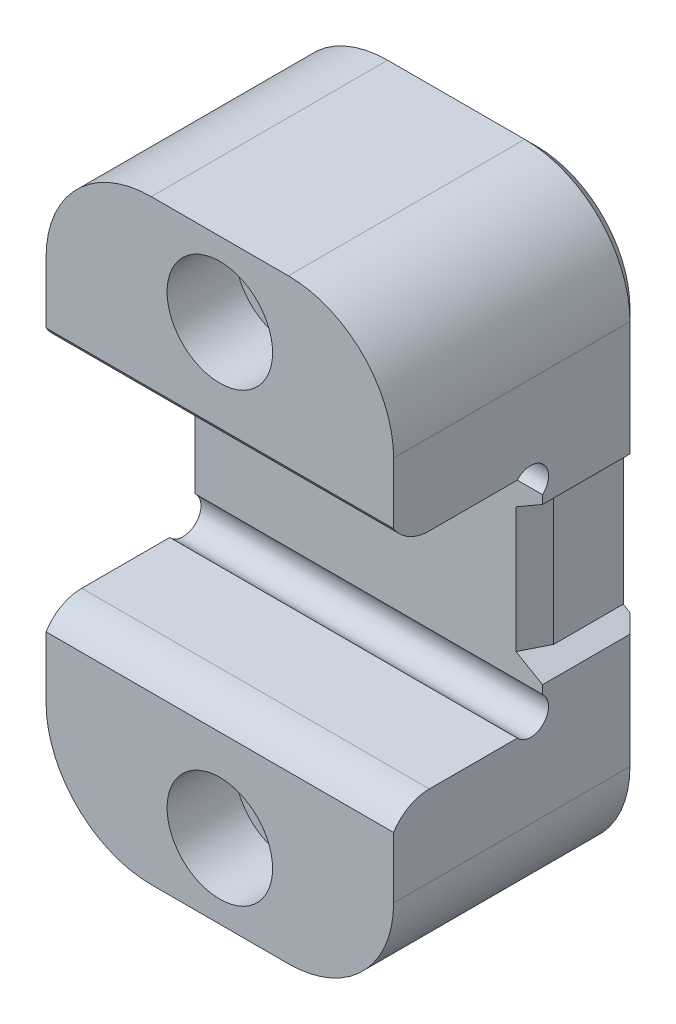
SolidWorks part; units mm, degrees
ref_plane "Front Plane" through (0, 0, 0) normal (0, 0, 1) x (1, 0, 0)
ref_plane "Top Plane" through (0, 0, 0) normal (0, 1, 0) x (1, 0, 0)
ref_plane "Right Plane" through (0, 0, 0) normal (1, 0, 0) x (0, 0, -1)
sketch "Sketch1" plane through (0, 0, 0) normal (1, 0, 0) x (0, 0, -1)
  line L0 (0, 0) -> (50000, 0) construction
  line L1 (0, 14.2875) -> (19.05, 14.2875)
  line L2 (0, 38.1) -> (31.75, 38.1)
  line L3 (0, 38.1) -> (0, 14.2875)
  line L4 (0, -38.1) -> (31.75, -38.1)
  line L5 (31.75, 38.1) -> (31.75, -38.1)
  line L6 (19.05, 14.2875) -> (19.05, -14.2875)
  line L7 (19.05, -14.2875) -> (0, -14.2875)
  line L9 (0, 24.4475) -> (0, -24.4475) construction
  line L10 (0, -14.2875) -> (0, -38.1)
  dimension "D1" = 31.75
  dimension "D2" = 76.2
  dimension "D3" = 19.05
  dimension "D4" = 28.575
extrude "Extrude1" add sketch "Sketch1" along normal mid plane 44.45
fillet "Fillet1" radius 13.462 4 edges at (-22.225, -38.1, -15.875) (-22.225, 38.1, -15.875) (22.225, -38.1, -15.875) (22.225, 38.1, -15.875)
sketch "Sketch2" plane through (-9.525, 0, -31.75) normal (0, 0, 1) x (1, 0, 0)
  line L0 (0, 0) -> (50000, 0) construction
  line L1 (31.75, -24.638) -> (31.75, 24.638) construction
  line L2 (29.3687, 8.6085) -> (32.5437, 10.4415)
  line L3 (29.3687, 8.6085) -> (29.3687, -8.6085)
  line L4 (29.3687, -8.6085) -> (32.5437, -10.4415)
  line L5 (32.5437, 10.4415) -> (32.5437, -10.4415)
  point P4 (30.9562, 9.525)
  point P10 (30.9562, -9.525)
  dimension "D1" = 19.05
  dimension "D2" = 2.3813
  dimension "D3" = 30
  dimension "D4" = 3.175
extrude "Cut-Extrude1" cut sketch "Sketch2" along normal through all
sketch "Sketch5" plane through (22.225, 0, 0) normal (1, 0, 0) x (0, 0, -1)
  line L0 (0, 0) -> (50000, 0) construction
  line L2 (0, 24.638) -> (0, 14.2875) construction
  line L3 (0, -14.2875) -> (0, -24.638) construction
  line L4 (-1.778, -13.6525) -> (4.572, -13.6525)
  line L5 (-1.778, -13.6525) -> (-1.778, -16.8275)
  line L6 (-1.778, -16.8275) -> (0, -16.8275)
  line L7 (4.572, -13.6525) -> (4.572, -14.2875)
  line L8 (19.05, -14.2875) -> (0, -14.2875) construction
  line L9 (4.572, 13.6525) -> (4.572, 14.2875)
  line L10 (-1.778, 16.8275) -> (0, 16.8275)
  line L11 (-1.778, 13.6525) -> (-1.778, 16.8275)
  line L12 (-1.778, 13.6525) -> (4.572, 13.6525)
  arc A0 (1.7842, -14.5973) -> (4.572, -14.2875) centre (4.572, -26.9875) cw construction
  arc A1 (0, -16.8275) -> (1.7842, -14.5973) centre (2.286, -16.8275) cw construction
  arc A2 (0, 16.8275) -> (1.7842, 14.5973) centre (2.286, 16.8275) ccw construction
  arc A3 (1.7842, 14.5973) -> (4.572, 14.2875) centre (4.572, 26.9875) ccw construction
  arc A4 (0, -16.8275) -> (4.572, -14.2875) centre (4.572, -19.6723) cw
  arc A5 (0, 16.8275) -> (4.572, 14.2875) centre (4.572, 19.6723) ccw
  dimension "D1" = 2.286
  dimension "D2" = 12.7
  dimension "D3" = 3.175
  dimension "D4" = 6.35
  dimension "D5" = 4.572
extrude "Cut-Extrude2" cut sketch "Sketch5" against normal through all
sketch "Sketch6" plane through (22.225, 0, 0) normal (1, 0, 0) x (0, 0, -1)
  line L0 (0, 0) -> (50000, 0) construction
  line L3 (19.05, 14.2875) -> (19.05, 9.9833) construction
  line L4 (4.572, 14.2875) -> (19.05, 14.2875) construction
  circle A0 centre (17.526, 12.7635) radius 2.286
  circle A1 centre (17.526, -12.7635) radius 2.286
  dimension "D2" = 0.762
  dimension "D3" = 2.286
  dimension "D1" = 0.762
extrude "Cut-Extrude3" cut sketch "Sketch6" against normal through all
hole_wizard "5/16\"-18 CBORE" positions "Sketch4" profile "Sketch3" counterbore size "5/16" standard "Ansi Inch"
sketch "Sketch4" plane through (0, 0, 0) normal (0, 0, 1) x (1, 0, 0)
  line L0 (0, 0) -> (0, 50000) construction
  line L1 (0, 0) -> (50000, 0) construction
  point P0 (0, 28.575)
  point P12 (0, -28.575)
  dimension "D1" = 57.15
sketch "Sketch3" plane through (0, 28.575, 0) normal (1, 0, 0) x (0, -1, 0)
  line L0 (0, 0) -> (0, 31.75)
  line L1 (0, 31.75) -> (3.9624, 31.75)
  line L3 (3.9624, 31.75) -> (3.9624, 8.7325)
  line L4 (3.9624, 8.7325) -> (6.7475, 8.7325)
  line L5 (6.7475, 8.7325) -> (6.7475, 0)
  line L7 (6.7475, 0) -> (0, 0)
  line L11 (0, -6.35) -> (0, 107.95) construction
  dimension "Thru Hole Dia." = 7.9248
  dimension "Thru Hole Depth" = 31.75
  dimension "C'Bore Dia." = 13.495
  dimension "C'Bore Depth" = 8.7325
hole_wizard "3/8-16 Tapped Hole1" positions "Sketch8" profile "Sketch7" tap size "3/8-16" standard "Ansi Inch"
sketch "Sketch8" plane through (0, 0, -8.7325) normal (0, 0, 1) x (1, 0, 0)
  point P0 (0, 28.575)
  point P1 (0, -28.575)
sketch "Sketch7" plane through (0, 28.575, -8.7325) normal (1, 0, 0) x (0, -1, 0)
  line L0 (0, 0) -> (0, 29.4523)
  line L1 (0, 29.4523) -> (4.1021, 26.9875)
  line L2 (4.1021, 26.9875) -> (4.1021, 0)
  line L5 (4.1021, 0) -> (0, 0)
  line L10 (0, 29.4523) -> (-4.1021, 26.9875) construction
  line L11 (0, -6.35) -> (0, 107.95) construction
  dimension "Tap Drill Dia." = 8.2042
  dimension "Tap Drill Depth" = 26.9875
  dimension "Drill Angle" = 118
chamfer "Chamfer3" distance 3.81 angle 15 1 edges at (19.8437, 0, -19.05)
chamfer "Chamfer1" distance 1.524 angle 45 9 edges at (-22.225, 0, -31.75) (-18.2821, -34.1571, -31.75) (0, -38.1, -31.75) (0, 38.1, -31.75) (-18.2821, 34.1571, -31.75) (22.225, -17.3106, -31.75) (18.2821, -34.1571, -31.75) (22.225, 17.3106, -31.75) (18.2821, 34.1571, -31.75)
